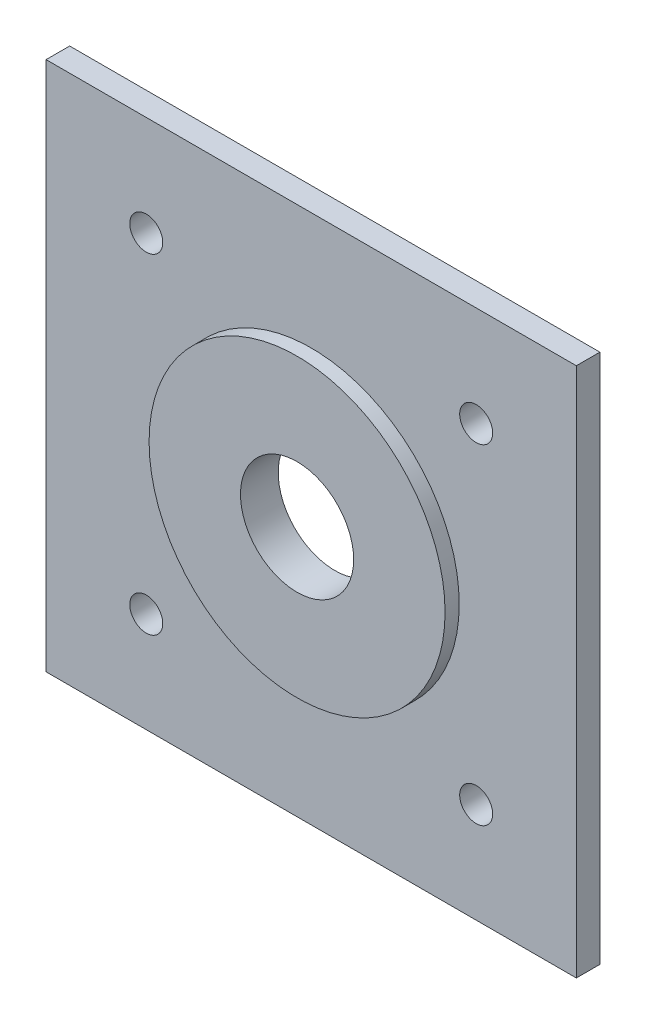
SolidWorks part; units mm, degrees
ref_plane "Front Plane" through (0, 0, 0) normal (0, 0, 1) x (1, 0, 0)
ref_plane "Top Plane" through (0, 0, 0) normal (0, 1, 0) x (1, 0, 0)
ref_plane "Right Plane" through (0, 0, 0) normal (1, 0, 0) x (0, 0, -1)
sketch "Sketch2" plane through (0, 0, 0) normal (0, 0, 1) x (1, 0, 0)
  line L1 (-56.25, 56.25) -> (56.25, 56.25)
  line L2 (-56.25, 56.25) -> (-56.25, -56.25)
  line L3 (-56.25, -56.25) -> (56.25, -56.25)
  line L4 (56.25, 56.25) -> (56.25, -56.25)
  line L5 (-56.25, 56.25) -> (56.25, -56.25) construction
  line L6 (-56.25, -56.25) -> (56.25, 56.25) construction
  point P1 (0, 0)
extrude "Boss-Extrude1" add sketch "Sketch2" along normal blind 5
sketch "Sketch3" plane through (0, 0, 5) normal (0, 0, 1) x (1, 0, 0)
  circle A0 centre (0, 0) radius 31.4
  dimension "D1" = 62.8
extrude "Boss-Extrude2" add sketch "Sketch3" along normal blind 3
sketch "Sketch4" plane through (0, 0, 8) normal (0, 0, 1) x (1, 0, 0)
  line L0 (-1000, 0) -> (49000, 0) construction
  line L1 (0, -1000) -> (0, 49000) construction
  line L2 (-56.25, -56.25) -> (56.25, 56.25) construction
  line L3 (56.25, -56.25) -> (-56.25, 56.25) construction
  line L4 (-56.25, 56.25) -> (-56.25, -56.25) construction
  line L5 (56.25, 56.25) -> (-56.25, 56.25) construction
  line L6 (-35, -1035) -> (-35, 48965) construction
  line L7 (32.8098, -1032.8098) -> (32.8098, 48967.1902) construction
  circle A0 centre (-35, 35) radius 3.5
  circle A1 centre (35, 35) radius 3.5
  circle A2 centre (35, -35) radius 3.5
  circle A3 centre (-35, -35) radius 3.5
  point P10 (0, 0)
  point P17 (0, 0)
  point P29 (0, 0)
  point P30 (171.2458, 1.5741)
  point P31 (148.381, -70.2441)
  dimension "D1" = 7
  dimension "D2" = 70
extrude "Cut-Extrude2" cut sketch "Sketch4" against normal blind 118
sketch "Sketch5" plane through (0, 0, 8) normal (0, 0, 1) x (1, 0, 0)
  circle A0 centre (0, 0) radius 12.005
  dimension "D1" = 24.01
extrude "Cut-Extrude3" cut sketch "Sketch5" against normal blind 52
equation "\"D2@Sketch2\"=\"D1@Sketch2\""
